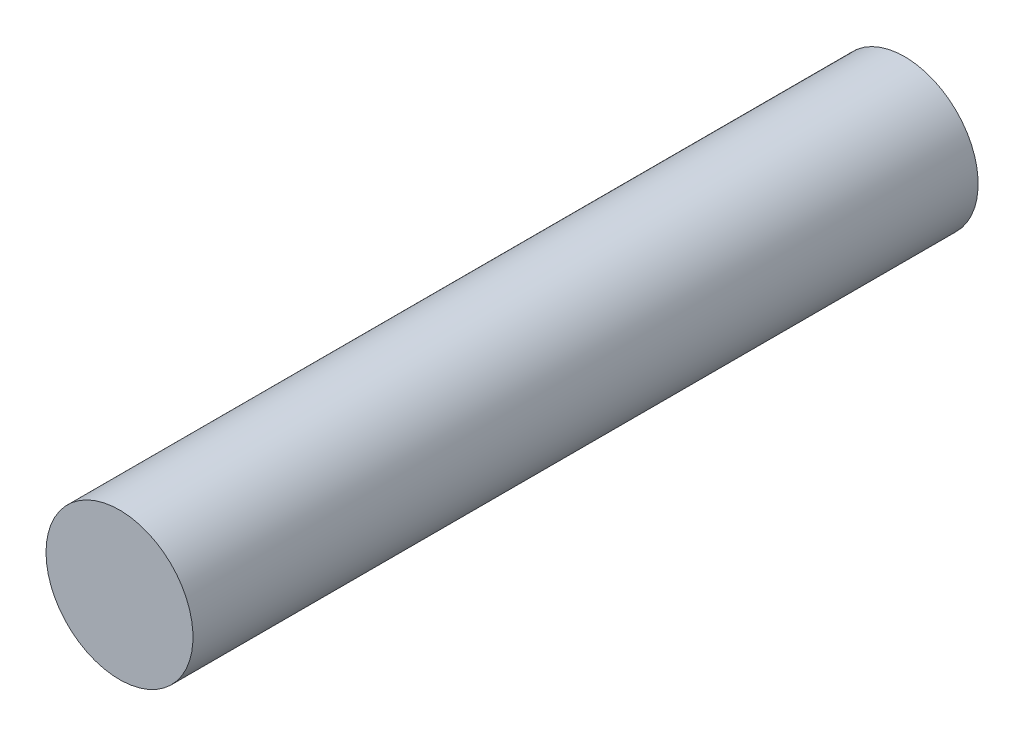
SolidWorks part; units mm, degrees
ref_plane "Front Plane" through (0, 0, 0) normal (0, 0, 1) x (1, 0, 0)
ref_plane "Top Plane" through (0, 0, 0) normal (0, 1, 0) x (1, 0, 0)
ref_plane "Right Plane" through (0, 0, 0) normal (1, 0, 0) x (0, 0, -1)
sketch "Sketch1" plane through (0, 0, 0) normal (0, 0, 1) x (1, 0, 0)
  circle A0 centre (0, 0) radius 38
  dimension "D1" = 76
extrude "Boss-Extrude1" add sketch "Sketch1" along normal mid plane 406
